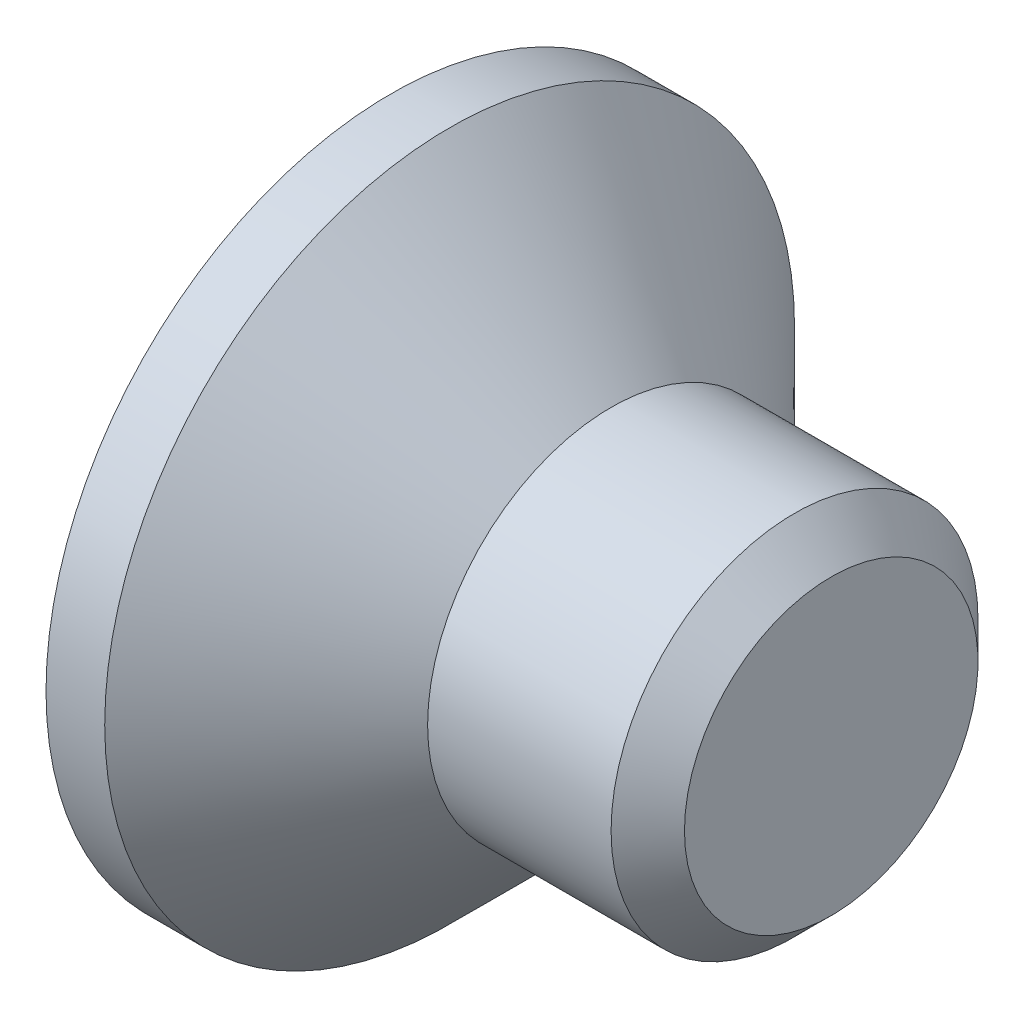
SolidWorks part; units mm, degrees
ref_plane "Front Plane" through (0, 0, 0) normal (0, 0, 1) x (1, 0, 0)
ref_plane "Top Plane" through (0, 0, 0) normal (0, 1, 0) x (1, 0, 0)
ref_plane "Right Plane" through (0, 0, 0) normal (1, 0, 0) x (0, 0, -1)
sketch "Sketch1" plane through (0, 0, 0) normal (0, 0, 1) x (1, 0, 0)
  line L1 (-1.5, 2.35) -> (-1.5, 0)
  line L2 (-1.5, 0) -> (1.5, 0)
  line L3 (1.5, 0) -> (1.5, 1.25)
  line L4 (1.5, 1.25) -> (0, 1.25)
  line L5 (-1.5, 2.35) -> (-1.1, 2.35)
  line L6 (-1.1, 2.35) -> (0, 1.25)
  dimension "D1" = 1.25
  dimension "D2" = 45
  dimension "D3" = 1.5
  dimension "D4" = 3
  dimension "D5" = 2.35
revolve "Revolve1" add sketch "Sketch1" angle 360 about L2
chamfer "Chamfer1" distance 0.25 angle 45 1 edges at (1.5, 0, 1.25)
sketch "Sketch2" plane through (-1.5, 0, 0) normal (-1, 0, 0) x (0, 0, 1)
  line L0 (-0.34, 1.35) -> (0.34, 1.35)
  line L1 (0.34, 1.35) -> (0.34, 0.34)
  line L2 (0.34, 0.34) -> (1.35, 0.34)
  line L3 (1.35, 0.34) -> (1.35, -0.34)
  line L4 (1.35, -0.34) -> (0.34, -0.34)
  line L5 (0.34, -0.34) -> (0.34, -1.35)
  line L6 (0.34, -1.35) -> (-0.34, -1.35)
  line L7 (-0.34, -1.35) -> (-0.34, -0.34)
  line L8 (-0.34, -0.34) -> (-1.35, -0.34)
  line L9 (-1.35, -0.34) -> (-1.35, 0.34)
  line L10 (-1.35, 0.34) -> (-0.34, 0.34)
  line L11 (-0.34, 0.34) -> (-0.34, 1.35)
  point P2 (0, 1.35)
  point P14 (0, -1.35)
  point P15 (1.35, 0)
  point P16 (-1.35, 0)
  point P17 (0.2443, 1.0495)
  point P18 (1.175, 0.2864)
  dimension "D1" = 2.7
  dimension "D2" = 0.68
extrude "Cut-Extrude1" cut sketch "Sketch2" against normal blind 1.25
